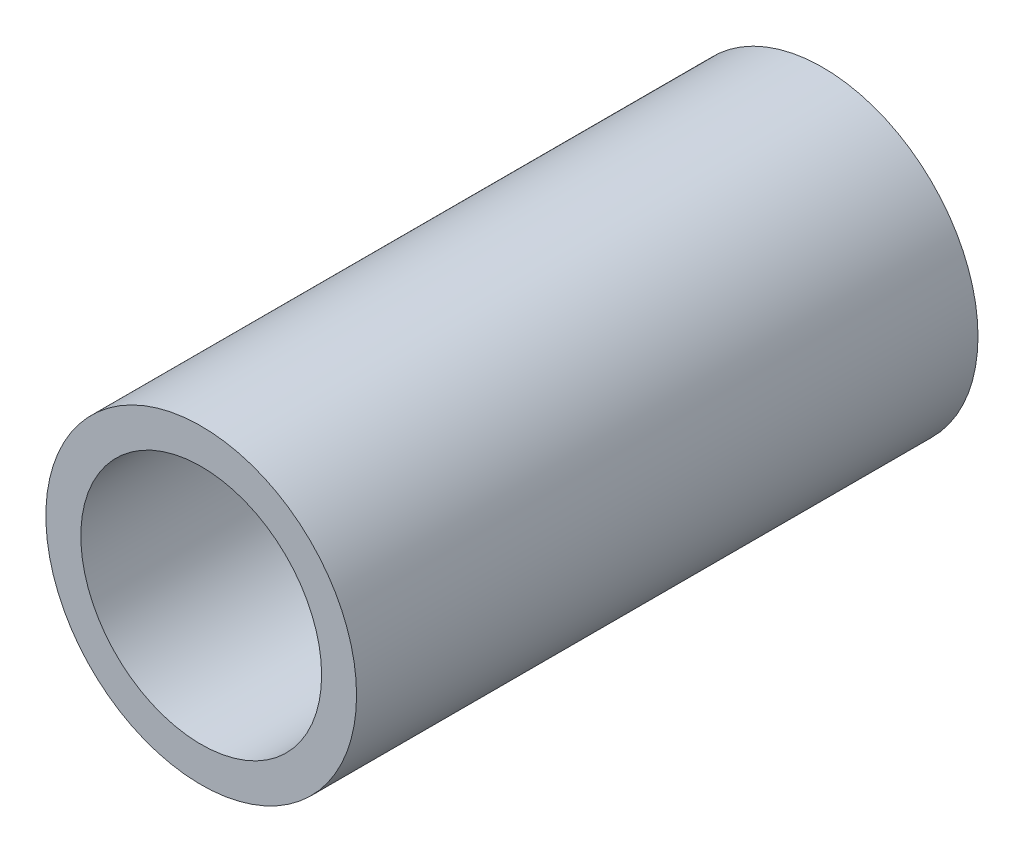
SolidWorks part; units mm, degrees
ref_plane "Plan de face" through (0, 0, 0) normal (0, 0, 1) x (1, 0, 0)
ref_plane "Plan de dessus" through (0, 0, 0) normal (0, 1, 0) x (1, 0, 0)
ref_plane "Plan de droite" through (0, 0, 0) normal (1, 0, 0) x (0, 0, -1)
sketch "Esquisse1" plane through (0, 0, 0) normal (0, 0, 1) x (1, 0, 0)
  circle A0 centre (0, 0) radius 2
  circle A1 centre (0, 0) radius 1.55
  dimension "D1" = 4
  dimension "D2" = 3.1
extrude "Extrusion1" add sketch "Esquisse1" along normal blind 8
